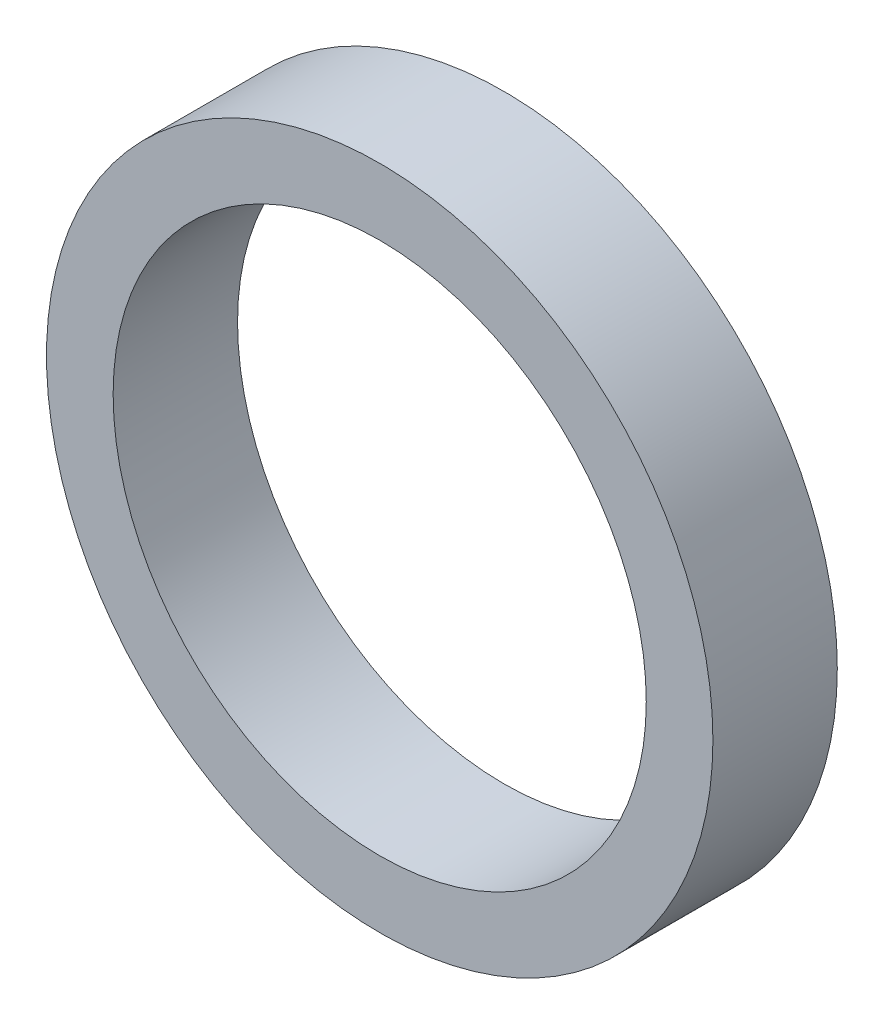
SolidWorks part; units mm, degrees
ref_plane "Plan de face" through (0, 0, 0) normal (0, 0, 1) x (1, 0, 0)
ref_plane "Plan de dessus" through (0, 0, 0) normal (0, 1, 0) x (1, 0, 0)
ref_plane "Plan de droite" through (0, 0, 0) normal (1, 0, 0) x (0, 0, -1)
sketch "Esquisse1" plane through (0, 0, 0) normal (0, 0, 1) x (1, 0, 0)
  circle A0 centre (0, 0) radius 6
  circle A1 centre (0, 0) radius 7.5
  dimension "D1" = 12
  dimension "D2" = 15
extrude "Extrusion1" add sketch "Esquisse1" along normal mid plane 2.8
